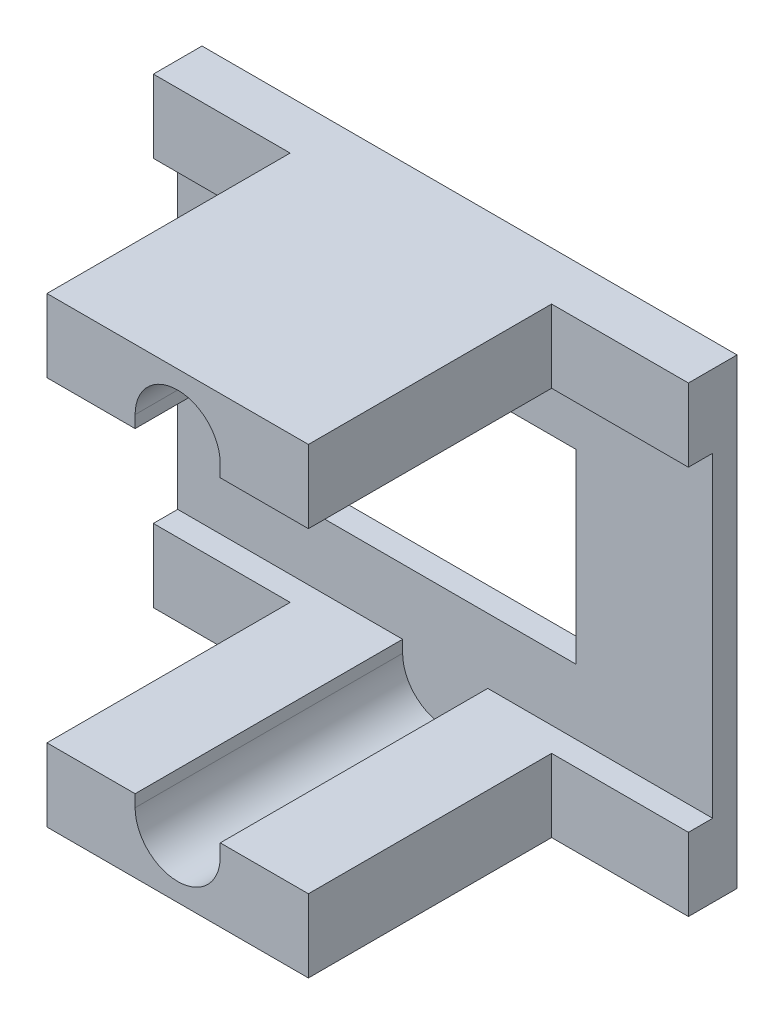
SolidWorks part; units mm, degrees
ref_plane "Front Plane" through (0, 0, 0) normal (0, 0, 1) x (1, 0, 0)
ref_plane "Top Plane" through (0, 0, 0) normal (0, 1, 0) x (1, 0, 0)
ref_plane "Right Plane" through (0, 0, 0) normal (1, 0, 0) x (0, 0, -1)
sketch "Sketch2" plane through (0, 0, 0) normal (0, 0, 1) x (1, 0, 0)
  line L1 (0, 0) -> (-22, 0)
  line L2 (0, 0) -> (0, 19)
  line L3 (0, 19) -> (-22, 19)
  line L4 (-22, 0) -> (-22, 19)
  line L5 (-16.375, 13.325) -> (-5.625, 13.325)
  line L6 (-16.375, 13.325) -> (-16.375, 5.675)
  line L7 (-16.375, 5.675) -> (-5.625, 5.675)
  line L8 (-5.625, 13.325) -> (-5.625, 5.675)
  line L9 (-16.375, 13.325) -> (-5.625, 5.675) construction
  line L10 (-16.375, 5.675) -> (-5.625, 13.325) construction
  point P5 (-11, 9.5)
  point P11 (-11, 19)
  point P13 (-22, 9.5)
  dimension "D1" = 22
  dimension "D2" = 19
  dimension "D3" = 10.75
  dimension "D4" = 7.65
extrude "Boss-Extrude1" add sketch "Sketch2" along normal blind 2
sketch "Sketch3" plane through (0, 0, 2) normal (0, 0, 1) x (1, 0, 0)
  line L0 (0, 19) -> (-22, 19) construction
  line L2 (-16.375, 16) -> (-16.375, 19)
  line L3 (-16.375, 19) -> (-5.625, 19)
  line L4 (-5.625, 16) -> (-5.625, 19)
  line L5 (-16.375, 13.325) -> (-16.375, 5.675) construction
  line L6 (-16.375, 16) -> (-5.625, 16)
  line L13 (-5.625, 5.675) -> (-5.625, 13.325) construction
  line L14 (-22, 0) -> (0, 0) construction
  line L15 (-16.375, 3) -> (-5.625, 3)
  line L16 (-16.375, 3) -> (-16.375, 0)
  line L17 (-16.375, 0) -> (-5.625, 0)
  line L18 (-5.625, 3) -> (-5.625, 0)
  dimension "D1" = 3
  dimension "D2" = 3
extrude "Boss-Extrude2" add sketch "Sketch3" along normal blind 10
sketch "Sketch5" plane through (0, 0, 2) normal (0, 0, 1) x (1, 0, 0)
  line L0 (-22, 19) -> (-22, 0) construction
  line L1 (-22, 16) -> (0, 16)
  line L2 (-22, 16) -> (-22, 3)
  line L3 (-22, 3) -> (0, 3)
  line L4 (0, 16) -> (0, 3)
  line L5 (0, 0) -> (0, 19) construction
  line L6 (-16.375, 16) -> (-5.625, 16) construction
  line L7 (-5.625, 3) -> (-16.375, 3) construction
extrude "Cut-Extrude2" cut sketch "Sketch5" against normal blind 1
sketch "Sketch4" plane through (0, 0, 2) normal (0, 0, 1) x (1, 0, 0)
  line L0 (-11, 15.5) -> (-11, 16.5) construction
  line L1 (-12.75, 15.5) -> (-12.75, 16.5)
  line L2 (-9.25, 15.5) -> (-9.25, 16.5)
  line L3 (-16.375, 16) -> (-5.625, 16) construction
  line L5 (-11, 3.5) -> (-11, 2.5) construction
  line L6 (-9.25, 3.5) -> (-9.25, 2.5)
  line L7 (-12.75, 3.5) -> (-12.75, 2.5)
  line L8 (-5.625, 3) -> (-16.375, 3) construction
  arc A0 (-12.75, 15.5) -> (-9.25, 15.5) centre (-11, 15.5) ccw
  arc A1 (-9.25, 16.5) -> (-12.75, 16.5) centre (-11, 16.5) ccw
  arc A2 (-9.25, 3.5) -> (-12.75, 3.5) centre (-11, 3.5) ccw
  arc A3 (-12.75, 2.5) -> (-9.25, 2.5) centre (-11, 2.5) ccw
  point P2 (-11, 16)
  point P9 (-11, 3)
  point P20 (-11, 16)
  dimension "D1" = 1.75
  dimension "D2" = 1.75
  dimension "D3" = 1
  dimension "D4" = 1
extrude "Cut-Extrude1" cut sketch "Sketch4" along normal up to surface and the other way up to surface
